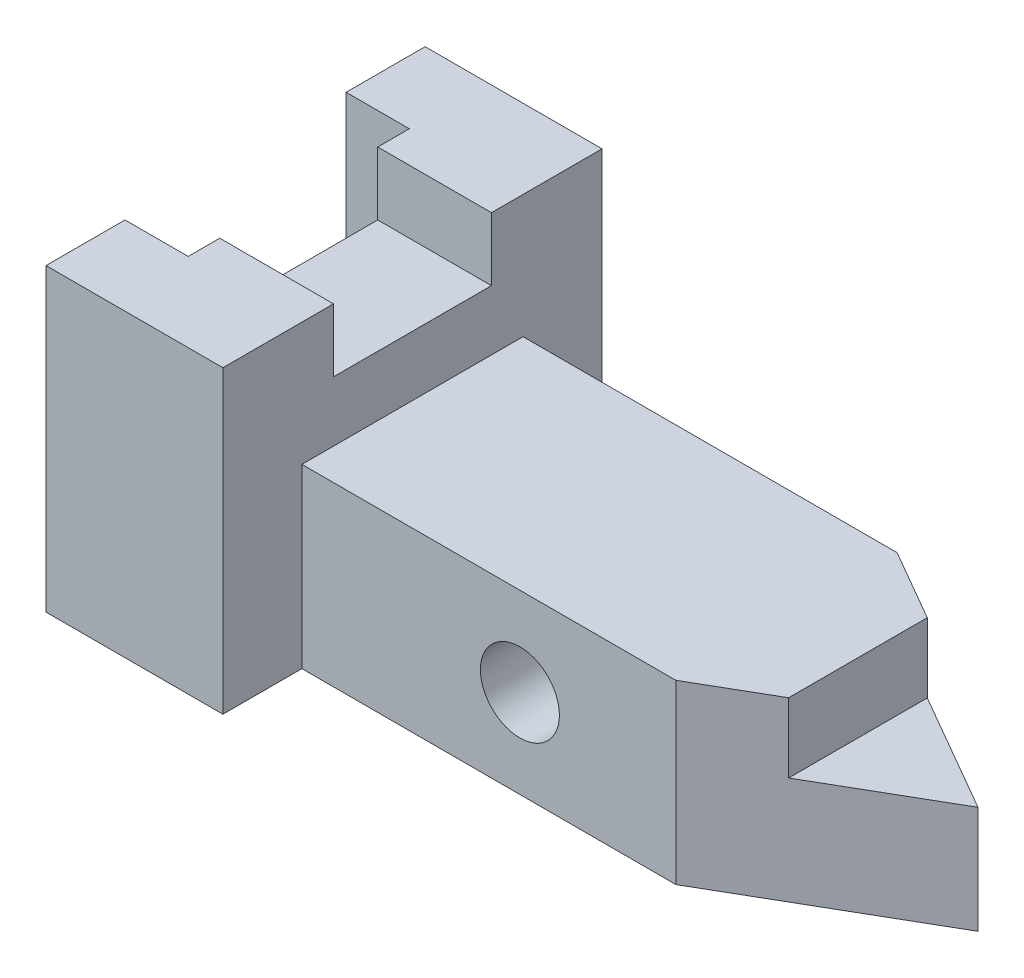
SolidWorks part; units mm, degrees
ref_plane "Front Plane" through (0, 0, 0) normal (0, 0, 1) x (1, 0, 0)
ref_plane "Top Plane" through (0, 0, 0) normal (0, 1, 0) x (1, 0, 0)
ref_plane "Right Plane" through (0, 0, 0) normal (1, 0, 0) x (0, 0, -1)
sketch "Sketch1" plane through (0, 0, 0) normal (0, 1, 0) x (1, 0, 0)
  line L0 (90.932, 17.78) -> (60.1361, 35.56)
  line L1 (0, 0) -> (60.1361, 0)
  line L2 (0, 0) -> (0, 35.56)
  line L3 (0, 35.56) -> (60.1361, 35.56)
  line L5 (60.1361, 35.56) -> (60.1361, 0) construction
  line L6 (60.1361, 0) -> (90.932, 17.78)
  point P1 (0, 0)
  point P3 (0, 17.78)
  dimension "D1" = 35.56
  dimension "D2" = 90.932
  dimension "D3" = 60
extrude "Boss-Extrude1" add sketch "Sketch1" along normal blind 28.448
sketch "Sketch2" plane through (0, 28.448, 0) normal (0, 1, 0) x (1, 0, 0)
  line L0 (90.932, 17.78) -> (71.628, 17.78) construction
  line L1 (71.628, 6.6348) -> (71.628, 28.9252)
  line L2 (90.932, 17.78) -> (60.1361, 35.56) construction
  line L3 (71.628, 28.9252) -> (90.932, 17.78)
  line L4 (90.932, 17.78) -> (71.628, 6.6348)
  point P8 (71.628, 17.78)
  dimension "D1" = 19.304
extrude "Cut-Extrude1" cut sketch "Sketch2" against normal blind 11.176
sketch "Sketch3" plane through (0, 0, 0) normal (0, 0, 1) x (1, 0, 0)
  line L0 (0, 28.448) -> (0, 0) construction
  circle A0 centre (35.052, 14.224) radius 6.35
  point P4 (0, 0)
  point P5 (0, 14.224)
  dimension "D1" = 12.7
  dimension "D2" = 35.052
extrude "Cut-Extrude2" cut sketch "Sketch3" against normal through all both and the other way through all
sketch "Sketch4" plane through (0, 0, 0) normal (-1, 0, 0) x (0, 0, 1)
  line L0 (-35.56, 0) -> (0, 0) construction
  line L1 (-48.26, 48.26) -> (12.7, 48.26)
  line L2 (-48.26, 48.26) -> (-48.26, 0)
  line L3 (-48.26, 0) -> (12.7, 0)
  line L4 (12.7, 48.26) -> (12.7, 0)
  point P6 (-17.78, 0)
  point P7 (-17.78, 0)
  dimension "D1" = 60.96
  dimension "D2" = 48.26
extrude "Boss-Extrude2" add sketch "Sketch4" along normal blind 28.448
sketch "Sketch5" plane through (0, 0, 0) normal (1, 0, 0) x (0, 0, -1)
  line L0 (-12.7, 48.26) -> (48.26, 48.26) construction
  line L1 (30.48, 48.26) -> (5.08, 48.26)
  line L2 (30.48, 48.26) -> (30.48, 38.1)
  line L3 (30.48, 38.1) -> (5.08, 38.1)
  line L4 (5.08, 48.26) -> (5.08, 38.1)
  point P6 (17.78, 48.26)
  point P7 (17.78, 48.26)
  dimension "D1" = 25.4
  dimension "D2" = 10.16
extrude "Cut-Extrude3" cut sketch "Sketch5" against normal blind 28.448
sketch "Sketch6" plane through (-28.448, 0, 0) normal (-1, 0, 0) x (0, 0, 1)
  line L0 (-30.48, 48.26) -> (-48.26, 48.26) construction
  line L1 (-35.56, 48.26) -> (0, 48.26)
  line L2 (-35.56, 48.26) -> (-35.56, 0)
  line L3 (-35.56, 0) -> (0, 0)
  line L4 (0, 48.26) -> (0, 0)
  point P4 (-17.78, 0)
  dimension "D1" = 35.56
extrude "Cut-Extrude4" cut sketch "Sketch6" against normal blind 10.16
